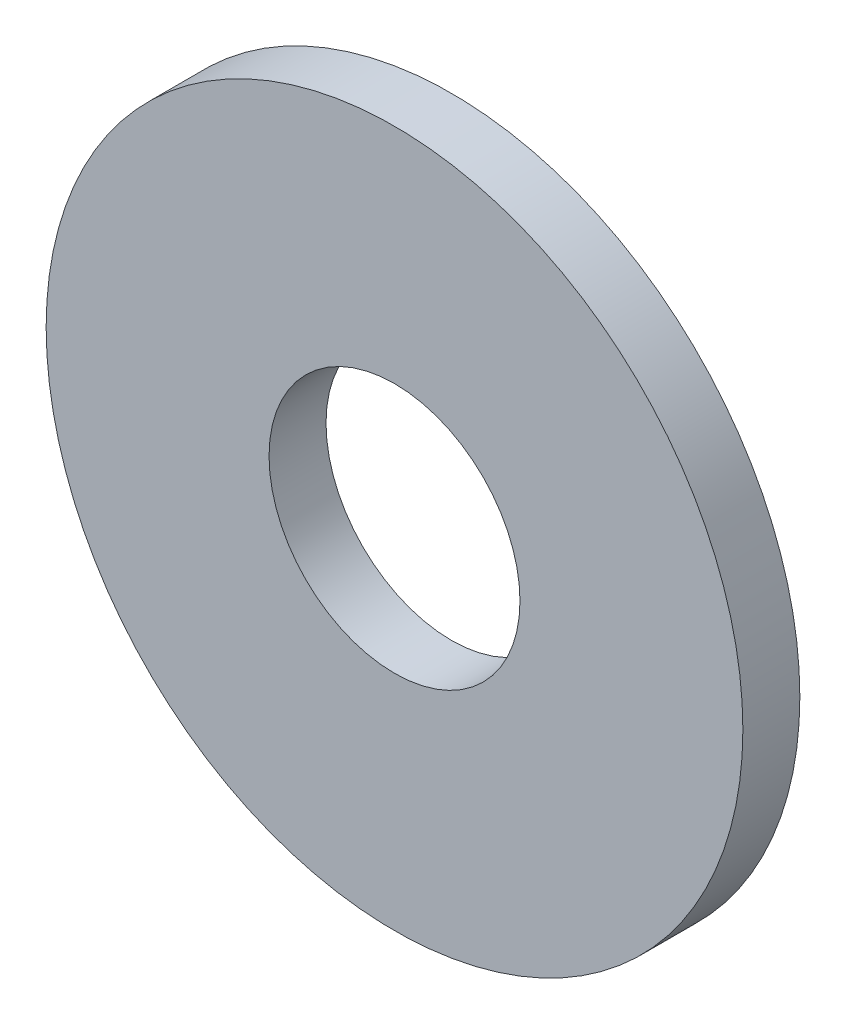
SolidWorks part; units mm, degrees
ref_plane "Front Plane" through (0, 0, 0) normal (0, 0, 1) x (1, 0, 0)
ref_plane "Top Plane" through (0, 0, 0) normal (0, 1, 0) x (1, 0, 0)
ref_plane "Right Plane" through (0, 0, 0) normal (1, 0, 0) x (0, 0, -1)
sketch "Sketch1" plane through (0, 0, 0) normal (0, 0, 1) x (1, 0, 0)
  circle A0 centre (0, 0) radius 11.8
  circle A1 centre (0, 0) radius 4.25
  dimension "D1" = 23.6
  dimension "D2" = 8.5
extrude "Boss-Extrude2" add sketch "Sketch1" along normal blind 1.93
